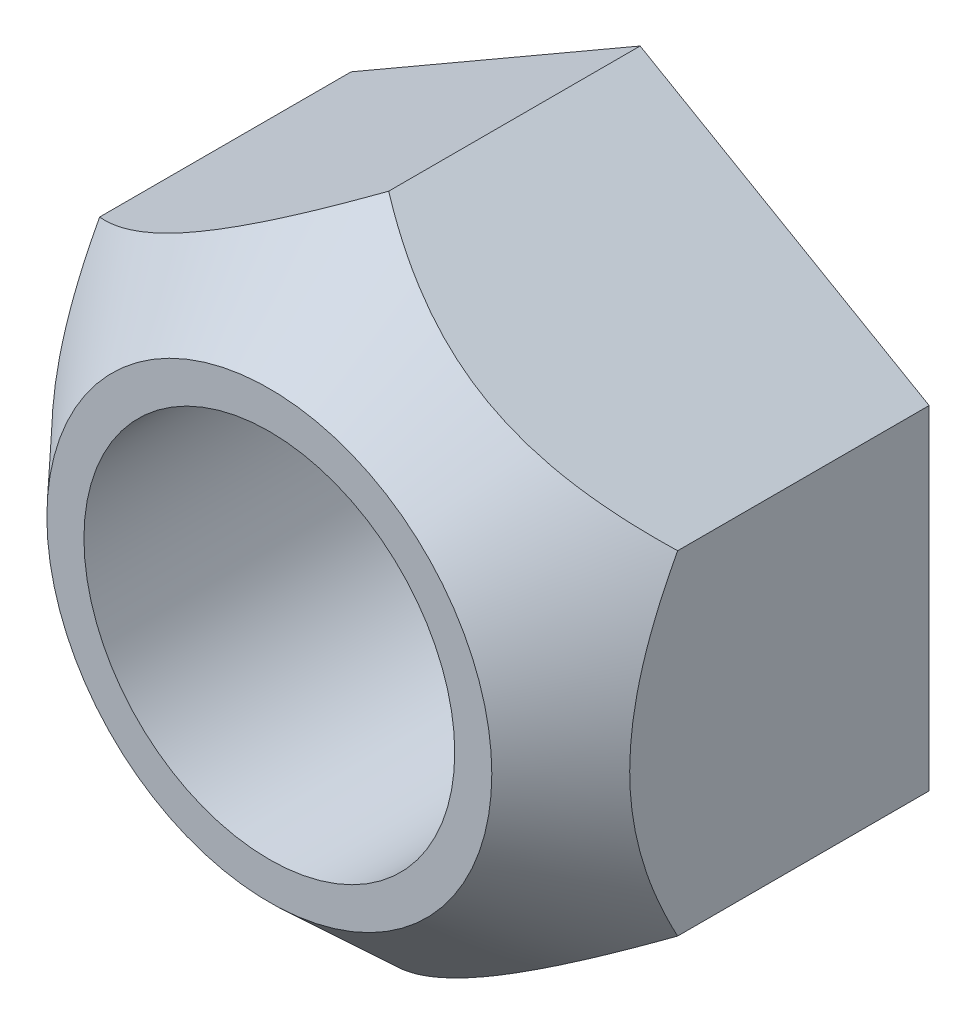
SolidWorks part; units mm, degrees
ref_plane "Face" through (0, 0, 0) normal (0, 0, 1) x (1, 0, 0)
ref_plane "Dessus" through (0, 0, 0) normal (0, 1, 0) x (1, 0, 0)
ref_plane "Droite" through (0, 0, 0) normal (1, 0, 0) x (0, 0, -1)
sketch "Esquisse1" plane through (0, 0, 0) normal (0, 0, 1) x (1, 0, 0)
  line L1 (0, -4.5) -> (3.8971, -2.25)
  line L2 (3.8971, -2.25) -> (3.8971, 2.25)
  line L3 (3.8971, 2.25) -> (0, 4.5)
  line L4 (0, 4.5) -> (-3.8971, 2.25)
  line L5 (-3.8971, 2.25) -> (-3.8971, -2.25)
  line L6 (-3.8971, -2.25) -> (0, -4.5)
  circle A0 centre (0, 0) radius 3.8971 construction
  dimension "D1" = 4.5
extrude "Extrusion1" add sketch "Esquisse1" against normal blind 5
sketch "Esquisse2" plane through (0, 0, 0) normal (0, 0, 1) x (1, 0, 0)
  circle A0 centre (0, 0) radius 2.5
  dimension "D1" = 5
extrude "Enlèv. mat.-Extru.1" cut sketch "Esquisse2" against normal blind 5
sketch "Esquisse3" plane through (0, 0, 0) normal (0, 0, 1) x (1, 0, 0)
  circle A1 centre (0, 0) radius 3
  circle A2 centre (0, 0) radius 8
  dimension "D1" = 6
  dimension "D2" = 16
extrude "Enlèv. mat.-Extru.2" cut sketch "Esquisse3" against normal blind 5 draft 43
